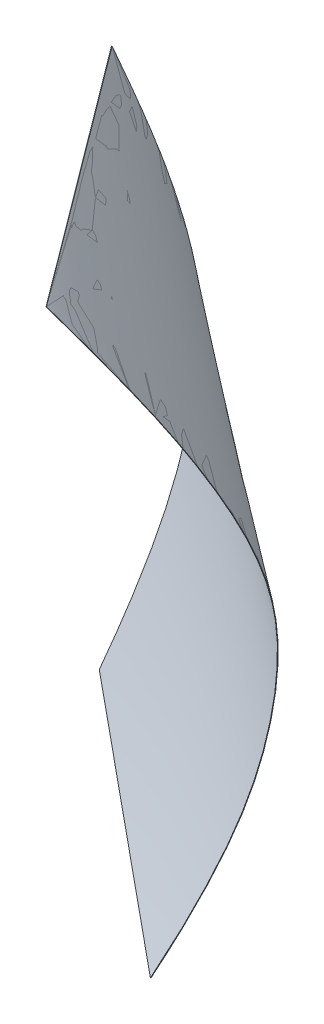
SolidWorks part; units mm, degrees
ref_plane "Ebene vorne" through (0, 0, 0) normal (0, 0, 1) x (1, 0, 0)
ref_plane "Ebene oben" through (0, 0, 0) normal (0, 1, 0) x (1, 0, 0)
ref_plane "Ebene rechts" through (0, 0, 0) normal (1, 0, 0) x (0, 0, -1)
curve "Importierte Kurve1"
curve "Importierte Kurve2"
curve "Importierte Kurve3"
curve "Importierte Kurve4"
curve "Importierte Kurve5"
curve "Importierte Kurve6"
curve "Importierte Kurve7"
curve "Importierte Kurve8"
curve "Importierte Kurve9"
curve "Importierte Kurve10"
curve "Importierte Kurve11"
curve "Importierte Kurve12"
curve "Importierte Kurve13"
curve "Importierte Kurve14"
curve "Importierte Kurve15"
curve "Importierte Kurve16"
curve "Importierte Kurve17"
ref_plane "Ebene4" through (19433.3611, 77987.4531, 0) normal (0.2418, 0.9703, 0) x (-0.9703, 0.2418, 0)
ref_plane "Ebene5" through (19434.57, 77992.3047, 0) normal (0.2418, 0.9703, 0) x (-0.9703, 0.2418, 0)
ref_plane "Ebene6" through (28393.7138, 78062.7747, 0) normal (0.3418, 0.9398, 0) x (-0.9398, 0.3418, 0)
ref_plane "Ebene7" through (28392.0047, 78058.0759, 0) normal (0.3418, 0.9398, 0) x (-0.9398, 0.3418, 0)
surface "Oberfläche-Ausformung1"
surface "Oberfläche-Trimmen2"
surface "Oberfläche-Trimmen3"
surface "Oberfläche-Trimmen4"
sketch3d "3D-Skizze1"
  spline S0 degree 3 poles (24574.1924, 79446.7258, 8375.166) (24607.5914, 79406.7872, 8354.0075) (24646.4677, 79359.966, 8329.1733) (24707.9136, 79283.4756, 8289.0334) (24756.2301, 79221.5953, 8256.8682) (24808.9784, 79149.5636, 8220.3088) (24862.981, 79071.0502, 8181.3869) (24896.1953, 79017.6311, 8155.7173) (24943.064, 78933.6464, 8116.3927) (24975.4605, 78867.1026, 8086.1977) (25007.3467, 78788.1109, 8052.2535) (25028.7877, 78729.8563, 8028.0304) (25048.7775, 78667.92, 8003.5382) (25065.4071, 78604.1787, 7980.6786) (25073.0958, 78569.2257, 7969.1425) (25079.2365, 78539.5072, 7959.6158) (25090.8242, 78476.8782, 7940.5011) (25097.9032, 78412.6285, 7924.3955) (25101.5293, 78341.7835, 7909.8215) (25102.3711, 78295.6946, 7901.508) (25100.0673, 78227.4144, 7891.7887) (25096.0996, 78175.0978, 7885.8613) (25088.0227, 78096.2114, 7878.233) (25074.7977, 78006.5119, 7871.946) (25058.986, 77926.7957, 7868.6383) (25040.7586, 77842.271, 7865.9195) (25028.2052, 77790.5986, 7865.012) (24995.9463, 77670.3745, 7864.5931) (24975.2622, 77602.0801, 7865.6638) (24939.0488, 77493.6766, 7869.3471) (24924.7155, 77453.1289, 7871.189) (24905.2647, 77400.5663, 7874.0962) (24890.6975, 77361.7333, 7876.3617) (24875.6207, 77323.1166, 7878.9691) (24847.473, 77252.6737, 7884.1174) (24829.2844, 77208.85, 7887.7319) (24788.8334, 77114.0353, 7896.2413) (24766.4208, 77063.1198, 7901.2441) (24696.9035, 76909.2088, 7917.5235) (24648.3104, 76806.9977, 7929.9231) (24598.572, 76705.5091, 7943.3667) knots 0 0 0 0 0.054939 0.064254 0.103631 0.137876 0.158558 0.204252 0.204252 0.260136 0.282302 0.293884 0.325269 0.350252 0.362024 0.362024 0.381346 0.427015 0.427015 0.452142 0.472774 0.494452 0.503747 0.550647 0.583242 0.583242 0.635219 0.635219 0.704934 0.704934 0.74701 0.74701 0.759798 0.787616 0.787616 0.834128 0.834128 0.888732 0.888732 1 1 1 1 construction
  spline S1 degree 3 poles (24574.1924, 79446.7258, 8375.166) (24607.5914, 79406.7872, 8354.0075) (24646.4677, 79359.966, 8329.1733) (24707.9136, 79283.4756, 8289.0334) (24756.2301, 79221.5953, 8256.8682) (24808.9784, 79149.5636, 8220.3088) (24862.981, 79071.0502, 8181.3869) (24896.1953, 79017.6311, 8155.7173) (24943.064, 78933.6464, 8116.3927) (24975.4605, 78867.1026, 8086.1977) (25007.3467, 78788.1109, 8052.2535) (25028.7877, 78729.8563, 8028.0304) (25048.7775, 78667.92, 8003.5382) (25065.4071, 78604.1787, 7980.6786) (25073.0958, 78569.2257, 7969.1425) (25079.2365, 78539.5072, 7959.6158) (25090.8242, 78476.8782, 7940.5011) (25097.9032, 78412.6285, 7924.3955) (25101.5293, 78341.7835, 7909.8215) (25102.3711, 78295.6946, 7901.508) (25100.0673, 78227.4144, 7891.7887) (25096.0996, 78175.0978, 7885.8613) (25088.0227, 78096.2114, 7878.233) (25074.7977, 78006.5119, 7871.946) (25058.986, 77926.7957, 7868.6383) (25040.7586, 77842.271, 7865.9195) (25028.2052, 77790.5986, 7865.012) (24995.9463, 77670.3745, 7864.5931) (24975.2622, 77602.0801, 7865.6638) (24939.0488, 77493.6766, 7869.3471) (24924.7155, 77453.1289, 7871.189) (24905.2647, 77400.5663, 7874.0962) (24890.6975, 77361.7333, 7876.3617) (24875.6207, 77323.1166, 7878.9691) (24847.473, 77252.6737, 7884.1174) (24829.2844, 77208.85, 7887.7319) (24788.8334, 77114.0353, 7896.2413) (24766.4208, 77063.1198, 7901.2441) (24696.9035, 76909.2088, 7917.5235) (24648.3104, 76806.9977, 7929.9231) (24598.572, 76705.5091, 7943.3667) knots 0 0 0 0 0.054939 0.064254 0.103631 0.137876 0.158558 0.204252 0.204252 0.260136 0.282302 0.293884 0.325269 0.350252 0.362024 0.362024 0.381346 0.427015 0.427015 0.452142 0.472774 0.494452 0.503747 0.550647 0.583242 0.583242 0.635219 0.635219 0.704934 0.704934 0.74701 0.74701 0.759798 0.787616 0.787616 0.834128 0.834128 0.888732 0.888732 1 1 1 1
sketch3d "3D-Skizze2"
  spline S0 degree 3 poles (23576.2663, 76960.2531, 7144.0536) (23576.5888, 76961.1256, 7143.9626) (23578.2472, 76965.6127, 7143.4948) (23590.5808, 76999.0208, 7140.0333) (23613.171, 77060.542, 7133.9566) (23644.7284, 77147.5864, 7126.1373) (23675.887, 77234.8357, 7119.1203) (23706.5924, 77322.3, 7112.9546) (23736.7602, 77410.0003, 7107.7264) (23761.4068, 77483.341, 7104.2084) (23780.7361, 77542.121, 7101.9763) (23794.8107, 77585.6129, 7100.6357) (23808.8705, 77629.8099, 7099.5955) (23827.3294, 77688.9147, 7098.6603) (23850.1212, 77764.137, 7098.3527) (23875.9339, 77853.4, 7099.3675) (23900.5462, 77942.9996, 7101.6688) (23919.8468, 78017.3723, 7104.5681) (23934.7098, 78077.4837, 7107.4873) (23945.5014, 78122.6528, 7109.9657) (23955.9477, 78168.0085, 7112.7461) (23965.9682, 78213.3336, 7115.8514) (23974.0432, 78251.5562, 7118.7709) (23980.2045, 78281.8615, 7121.2848) (23986.3943, 78313.1355, 7124.0197) (23993.5166, 78350.7248, 7127.5765) (24000.3307, 78389.074, 7131.5967) (24005.3009, 78418.6074, 7134.957) (24010.2347, 78449.1256, 7138.6359) (24015.9788, 78487.012, 7143.6158) (24021.2212, 78525.2288, 7149.2968) (24025.0681, 78555.813, 7154.2949) (24028.6725, 78586.4108, 7159.6185) (24031.8989, 78616.985, 7165.3896) (24034.7239, 78647.5277, 7171.5504) (24036.7278, 78671.5148, 7176.5816) (24038.4134, 78694.3948, 7181.5624) (24039.8806, 78717.2587, 7186.6928) (24041.0796, 78739.019, 7191.6998) (24042.4555, 78769.4575, 7198.8745) (24043.6231, 78807.452, 7208.1362) (24044.181, 78852.9489, 7219.6607) (24043.9423, 78898.3383, 7231.5322) (24043.1192, 78936.0755, 7241.6633) (24042.1205, 78966.2091, 7249.8865) (24041.2101, 78988.7795, 7256.1072) (24040.1448, 79011.3244, 7262.3795) (24038.5272, 79041.3569, 7270.808) (24036.1462, 79078.8524, 7281.4694) (24032.7252, 79123.761, 7294.4896) (24028.7491, 79168.5711, 7307.7612) (24024.2143, 79213.246, 7321.3102) (24019.1699, 79257.7683, 7335.1012) (24013.6771, 79302.1304, 7349.0914) (24007.7997, 79346.3473, 7363.2401) (23999.6079, 79404.6016, 7382.1026) (23988.5781, 79477.782, 7406.1824) (23976.8901, 79550.5613, 7430.5376) (23967.206, 79609.244, 7450.3482) (23961.3363, 79644.4047, 7462.2687) (23957.857, 79665.1602, 7469.3224) (23956.8315, 79671.278, 7471.4015) knots 0 0 0 0 0.00099 0.005091 0.0379 0.070708 0.103514 0.136316 0.169113 0.201907 0.218353 0.234699 0.250349 0.267493 0.300295 0.333601 0.365919 0.398744 0.415043 0.431582 0.448005 0.464431 0.480861 0.4895 0.497297 0.514754 0.530199 0.538772 0.546676 0.563176 0.5797 0.587974 0.596253 0.612818 0.621104 0.629392 0.638866 0.645971 0.654261 0.662551 0.679129 0.695701 0.712267 0.728823 0.737097 0.74537 0.753641 0.761911 0.778455 0.795008 0.81157 0.828136 0.84469 0.861229 0.87775 0.894258 0.926666 0.960185 0.976489 0.99307 1 1 1 1 construction
  spline S1 degree 3 poles (23576.2663, 76960.2531, 7144.0536) (23576.5888, 76961.1256, 7143.9626) (23578.2472, 76965.6127, 7143.4948) (23590.5808, 76999.0208, 7140.0333) (23613.171, 77060.542, 7133.9566) (23644.7284, 77147.5864, 7126.1373) (23675.887, 77234.8357, 7119.1203) (23706.5924, 77322.3, 7112.9546) (23736.7602, 77410.0003, 7107.7264) (23761.4068, 77483.341, 7104.2084) (23780.7361, 77542.121, 7101.9763) (23794.8107, 77585.6129, 7100.6357) (23808.8705, 77629.8099, 7099.5955) (23827.3294, 77688.9147, 7098.6603) (23850.1212, 77764.137, 7098.3527) (23875.9339, 77853.4, 7099.3675) (23900.5462, 77942.9996, 7101.6688) (23919.8468, 78017.3723, 7104.5681) (23934.7098, 78077.4837, 7107.4873) (23945.5014, 78122.6528, 7109.9657) (23955.9477, 78168.0085, 7112.7461) (23965.9682, 78213.3336, 7115.8514) (23974.0432, 78251.5562, 7118.7709) (23980.2045, 78281.8615, 7121.2848) (23986.3943, 78313.1355, 7124.0197) (23993.5166, 78350.7248, 7127.5765) (24000.3307, 78389.074, 7131.5967) (24005.3009, 78418.6074, 7134.957) (24010.2347, 78449.1256, 7138.6359) (24015.9788, 78487.012, 7143.6158) (24021.2212, 78525.2288, 7149.2968) (24025.0681, 78555.813, 7154.2949) (24028.6725, 78586.4108, 7159.6185) (24031.8989, 78616.985, 7165.3896) (24034.7239, 78647.5277, 7171.5504) (24036.7278, 78671.5148, 7176.5816) (24038.4134, 78694.3948, 7181.5624) (24039.8806, 78717.2587, 7186.6928) (24041.0796, 78739.019, 7191.6998) (24042.4555, 78769.4575, 7198.8745) (24043.6231, 78807.452, 7208.1362) (24044.181, 78852.9489, 7219.6607) (24043.9423, 78898.3383, 7231.5322) (24043.1192, 78936.0755, 7241.6633) (24042.1205, 78966.2091, 7249.8865) (24041.2101, 78988.7795, 7256.1072) (24040.1448, 79011.3244, 7262.3795) (24038.5272, 79041.3569, 7270.808) (24036.1462, 79078.8524, 7281.4694) (24032.7252, 79123.761, 7294.4896) (24028.7491, 79168.5711, 7307.7612) (24024.2143, 79213.246, 7321.3102) (24019.1699, 79257.7683, 7335.1012) (24013.6771, 79302.1304, 7349.0914) (24007.7997, 79346.3473, 7363.2401) (23999.6079, 79404.6016, 7382.1026) (23988.5781, 79477.782, 7406.1824) (23976.8901, 79550.5613, 7430.5376) (23967.206, 79609.244, 7450.3482) (23961.3363, 79644.4047, 7462.2687) (23957.857, 79665.1602, 7469.3224) (23956.8315, 79671.278, 7471.4015) knots 0 0 0 0 0.00099 0.005091 0.0379 0.070708 0.103514 0.136316 0.169113 0.201907 0.218353 0.234699 0.250349 0.267493 0.300295 0.333601 0.365919 0.398744 0.415043 0.431582 0.448005 0.464431 0.480861 0.4895 0.497297 0.514754 0.530199 0.538772 0.546676 0.563176 0.5797 0.587974 0.596253 0.612818 0.621104 0.629392 0.638866 0.645971 0.654261 0.662551 0.679129 0.695701 0.712267 0.728823 0.737097 0.74537 0.753641 0.761911 0.778455 0.795008 0.81157 0.828136 0.84469 0.861229 0.87775 0.894258 0.926666 0.960185 0.976489 0.99307 1 1 1 1
sheet metal parameters "Blech1" thickness 2 parameters "D1"=0.7366, "Dicke"=2
lofted bend "Ausgeformte Biegungen1" parameters "D1"=0, "D12"=2
other "Freiform-Biegung1" parameters "D1"=1000, "D4"=57.296, "D5"=1
flat pattern "Abwicklung1"
sketch "Biegung-Linien1" plane through (0, 0, 0) normal (0, 1, 0) x (-1, 0, 0)
other "Abwickeln-<Freiform-Biegung1>1"
